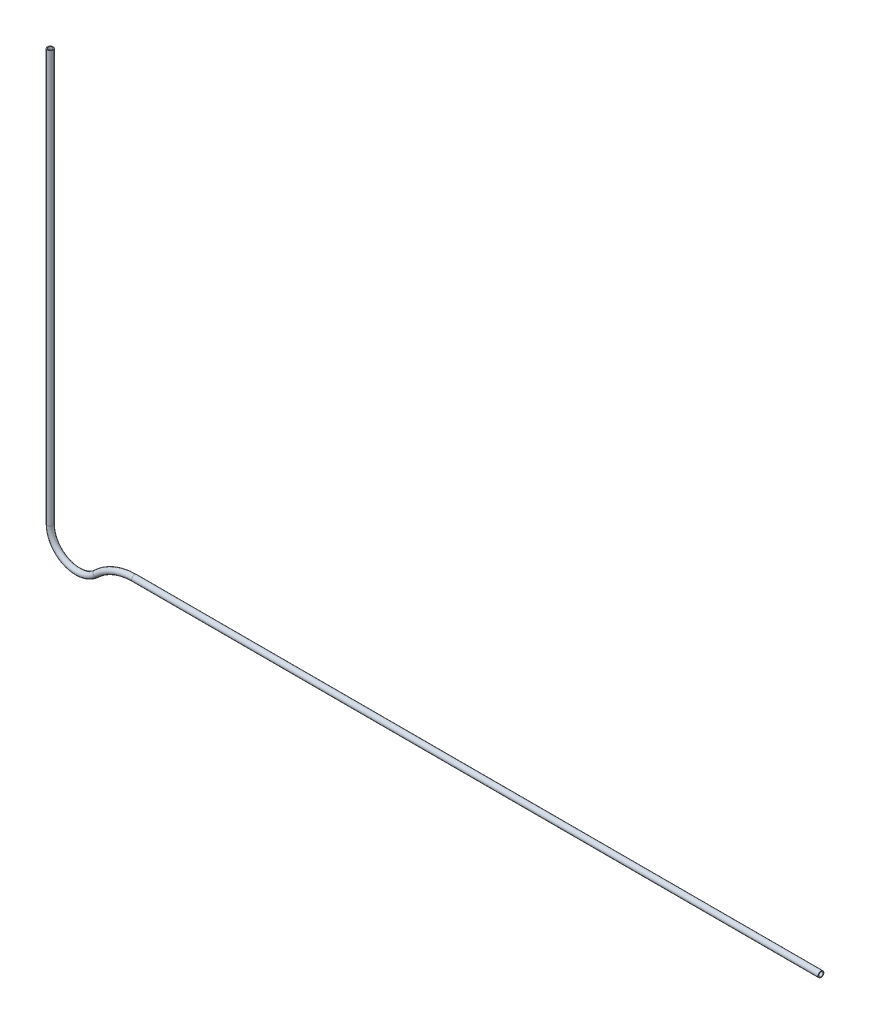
SolidWorks part; units mm, degrees
ref_plane "Спереди" through (0, 0, 0) normal (0, 0, 1) x (1, 0, 0)
ref_plane "Сверху" through (0, 0, 0) normal (0, 1, 0) x (1, 0, 0)
ref_plane "Справа" through (0, 0, 0) normal (1, 0, 0) x (0, 0, -1)
sketch "Эскиз1" plane through (0, 0, 0) normal (1, 0, 0) x (0, 0, -1)
  circle A0 centre (0, 0) radius 10.5
  dimension "D1" = 21
sketch "Эскиз2" plane through (0, 0, 0) normal (0, 0, 1) x (1, 0, 0)
  line L0 (-2500, 0) -> (0, 0)
  line L1 (-2806.9898, 17.1526) -> (-2806.9898, 1517.1526)
  arc A0 (-2637.9932, -55.2316) -> (-2806.9898, 17.1526) centre (-2706.9898, 17.1526) cw
  arc A1 (-2500, 0) -> (-2637.9932, -55.2316) centre (-2500, -200) ccw
  point P6 (-2021.291, 0)
  dimension "D3" = 100
  dimension "D1" = 200
  dimension "D2" = 2500
  dimension "D4" = 1500
sweep "По траектории-Тонкостенный1" add profiles "Эскиз1" path "Эскиз2" parameters "D1"=2.8
